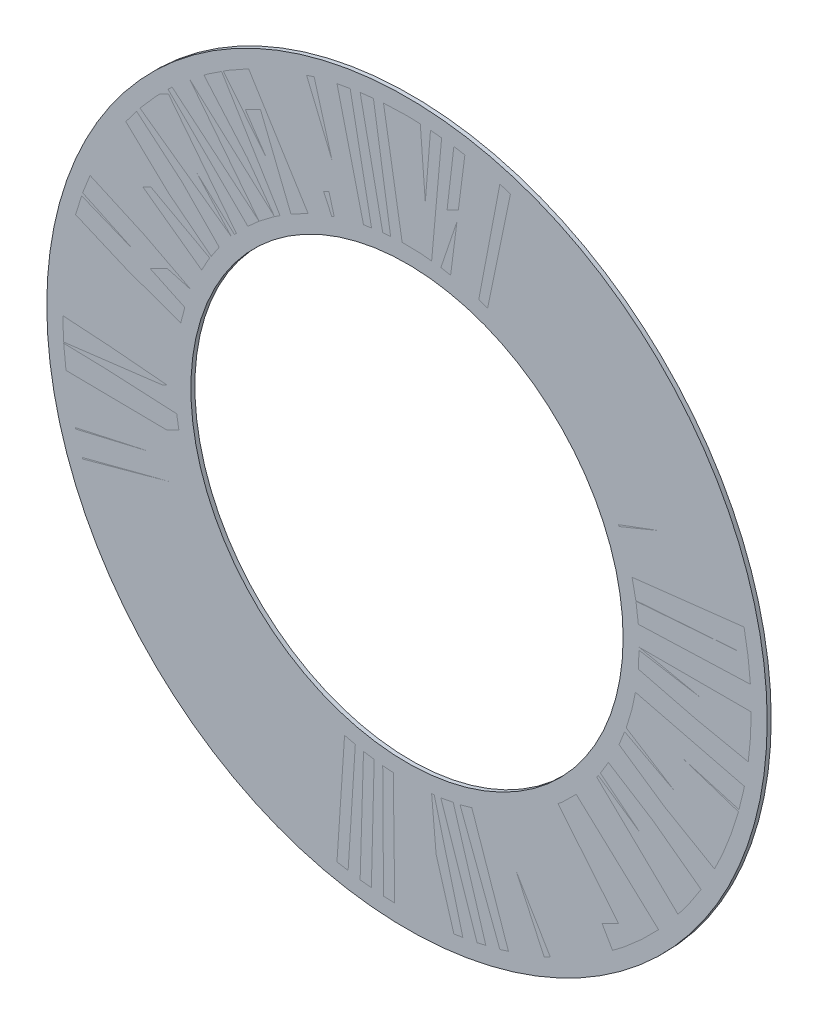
SolidWorks part; units mm, degrees
ref_plane "Plan de face" through (0, 0, 0) normal (0, 0, 1) x (1, 0, 0)
ref_plane "Plan de dessus" through (0, 0, 0) normal (0, 1, 0) x (1, 0, 0)
ref_plane "Plan de droite" through (0, 0, 0) normal (1, 0, 0) x (0, 0, -1)
sketch "Esquisse3" plane through (0, 0, 0) normal (0, 0, 1) x (1, 0, 0)
  circle A0 centre (0, -139) radius 58
  circle A1 centre (0, -139) radius 86
extrude "Extrusion2" add sketch "Esquisse3" along normal blind 1
sketch "Esquisse4"
extrude "Extrusion3" add sketch "Esquisse4" against normal blind 1.5
sketch "Esquisse5" plane through (0, 0, 0) normal (0, 0, 1) x (1, 0, 0)
  circle A0 centre (0, -139) radius 90
  circle A1 centre (0, -139) radius 54
extrude "Extrusion4" add sketch "Esquisse5" along normal blind 1
